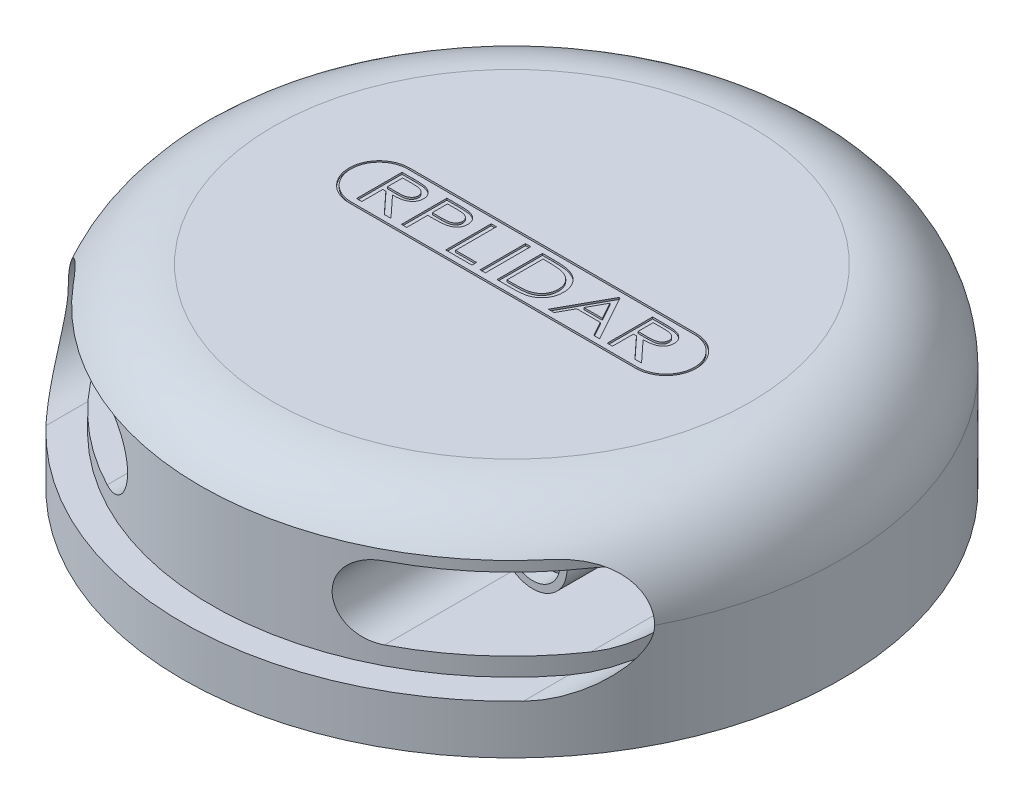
SolidWorks part; units mm, degrees
ref_plane "Ön Düzlem" through (0, 0, 0) normal (0, 0, 1) x (1, 0, 0)
ref_plane "Üst Düzlem" through (0, 0, 0) normal (0, 1, 0) x (1, 0, 0)
ref_plane "Sağ Düzlem" through (0, 0, 0) normal (1, 0, 0) x (0, 0, -1)
sketch "Çizim1" plane through (0, 0, 0) normal (0, 1, 0) x (1, 0, 0)
  circle A0 centre (0, 0) radius 36.25
  dimension "D1" = 72.5
extrude "Yükseklik-Ekstrüzyon1" add sketch "Çizim1" along normal blind 21.4
fillet "Radyus1" radius 10 1 edges at (0, 21.4, 36.25)
sketch "Çizim2" plane through (0, 0, 0) normal (0, 0, 1) x (1, 0, 0)
  line L0 (-36.25, 11.4) -> (36.25, 11.4) construction
  line L1 (-26.25, 11.4) -> (26.25, 11.4) construction
  line L2 (-26.25, 17.4) -> (26.25, 17.4)
  line L3 (-26.25, 5.4) -> (26.25, 5.4)
  arc A0 (-26.25, 17.4) -> (-26.25, 5.4) centre (-26.25, 11.4) ccw
  arc A1 (26.25, 5.4) -> (26.25, 17.4) centre (26.25, 11.4) ccw
  point P6 (0, 11.4)
  dimension "D1" = 10
  dimension "D2" = 10
  dimension "D3" = 12
extrude "Kes-Ekstrüzyon1" cut sketch "Çizim2" along normal blind 41.4 contours L3 A1 L2 A0
sketch "Çizim3" plane through (0, 5.4, 0) normal (0, 1, 0) x (1, 0, 0)
  circle A0 centre (0, 0) radius 33.0032
extrude "Yükseklik-Ekstrüzyon2" add sketch "Çizim3" along normal blind 12.4
sketch "Çizim4" plane through (0, 0, 0) normal (0, 0, 1) x (1, 0, 0)
  line L0 (-32.25, 11.4) -> (32.25, 11.4) construction
  line L1 (-27.25, 11.4) -> (-15.25, 11.4) construction
  line L2 (-27.25, 15.4) -> (-15.25, 15.4)
  line L3 (-27.25, 7.4) -> (-15.25, 7.4)
  line L4 (0, 0) -> (0, 17.4) construction
  line L5 (-26.25, 17.4) -> (26.25, 17.4) construction
  line L6 (27.25, 11.4) -> (15.25, 11.4) construction
  line L7 (27.25, 15.4) -> (15.25, 15.4)
  line L8 (27.25, 7.4) -> (15.25, 7.4)
  arc A0 (-27.25, 15.4) -> (-27.25, 7.4) centre (-27.25, 11.4) ccw
  arc A1 (-15.25, 7.4) -> (-15.25, 15.4) centre (-15.25, 11.4) ccw
  arc A2 (27.25, 15.4) -> (27.25, 7.4) centre (27.25, 11.4) cw
  arc A3 (15.25, 7.4) -> (15.25, 15.4) centre (15.25, 11.4) cw
  point P6 (-21.25, 11.4)
  point P18 (21.25, 11.4)
  dimension "D1" = 8
  dimension "D2" = 5
  dimension "D3" = 12
extrude "Kes-Ekstrüzyon2" cut sketch "Çizim4" along normal blind 44.4
sketch "Çizim5" plane through (0, 0, 0) normal (0, 0, 1) x (1, 0, 0)
  line L0 (-32.25, 11.4) -> (32.25, 11.4) construction
  circle A0 centre (18.2814, 11.4) radius 3.775
  circle A1 centre (18.2814, 11.4) radius 3
  circle A2 centre (-26.25, 11.4) radius 3
  circle A3 centre (-26.25, 11.4) radius 1.5
  dimension "D1" = 6
  dimension "D2" = 6
  dimension "D3" = 3
  dimension "D4" = 7.55
extrude "Yükseklik-Ekstrüzyon4" add sketch "Çizim5" along normal blind 16
sketch "Çizim6" plane through (0, 0, 0) normal (0, -1, 0) x (1, 0, 0)
  circle A0 centre (0, 0) radius 35
  dimension "D1" = 70
extrude "Kes-Ekstrüzyon3" cut sketch "Çizim6" against normal blind 5
sketch "Çizim8" plane through (0, 0, 16) normal (0, 0, 1) x (1, 0, 0)
  circle A0 centre (-26.25, 11.4) radius 1.5
  circle A1 centre (18.2814, 11.4) radius 3
extrude "Yükseklik-Ekstrüzyon5" add sketch "Çizim8" along normal blind 1 from offset 3
sketch "Çizim9" plane through (0, 21.4, 0) normal (0, 1, 0) x (1, 0, 0)
  text T0 "RPLIDAR" font "Century Gothic" height 5
extrude "Kes-Ekstrüzyon4" cut sketch "Çizim9" against normal blind 0.2
sketch "Çizim10" plane through (0, 21.4, 0) normal (0, 1, 0) x (1, 0, 0)
  line L0 (-14.8113, 0.221) -> (16.7289, 0.221) construction
  line L1 (-14.8113, -2.279) -> (-14.8113, 2.721) construction
  line L2 (-14.8113, 0.221) -> (16.7289, 0.221) construction
  line L3 (-14.8113, 3.3453) -> (16.7289, 3.3453)
  line L4 (-14.8113, -2.9033) -> (16.7289, -2.9033)
  line L5 (-14.8113, 3.5453) -> (16.7289, 3.5453)
  line L6 (-14.8113, -3.1033) -> (16.7289, -3.1033)
  arc A0 (-14.8113, 3.3453) -> (-14.8113, -2.9033) centre (-14.8113, 0.221) ccw
  arc A1 (16.7289, -2.9033) -> (16.7289, 3.3453) centre (16.7289, 0.221) ccw
  arc A2 (16.7289, -3.1033) -> (16.7289, 3.5453) centre (16.7289, 0.221) ccw
  arc A3 (-14.8113, 3.5453) -> (-14.8113, -3.1033) centre (-14.8113, 0.221) ccw
  point P4 (0.9588, 0.221)
  dimension "D1" = 0.2
extrude "Kes-Ekstrüzyon5" cut sketch "Çizim10" against normal blind 0.2
